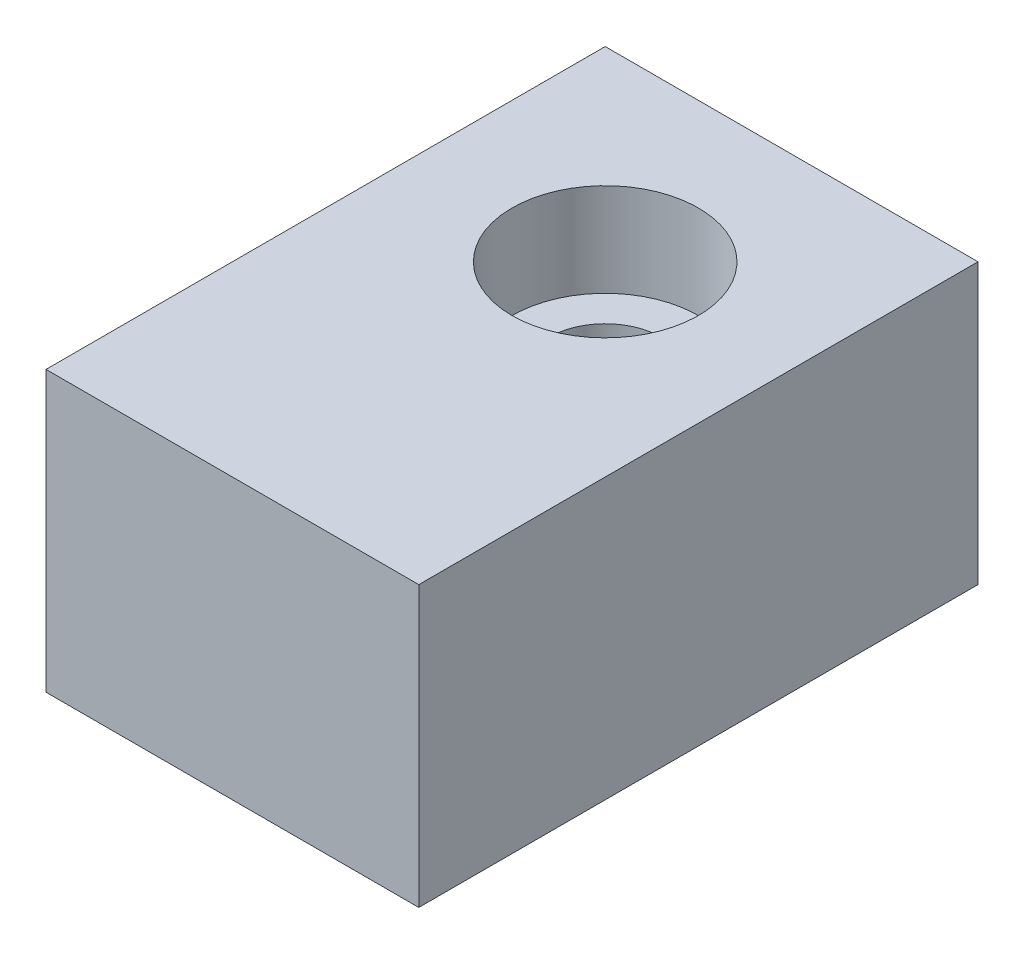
SolidWorks part; units mm, degrees
ref_plane "前视基准面" through (0, 0, 0) normal (0, 0, 1) x (1, 0, 0)
ref_plane "上视基准面" through (0, 0, 0) normal (0, 1, 0) x (1, 0, 0)
ref_plane "右视基准面" through (0, 0, 0) normal (1, 0, 0) x (0, 0, -1)
sketch "草图1" plane through (0, 0, 0) normal (1, 0, 0) x (0, 0, -1)
  line L1 (-15, -7.5) -> (15, -7.5)
  line L2 (-15, -7.5) -> (-15, 7.5)
  line L3 (-15, 7.5) -> (15, 7.5)
  line L4 (15, -7.5) -> (15, 7.5)
  line L5 (-15, -7.5) -> (15, 7.5) construction
  line L6 (-15, 7.5) -> (15, -7.5) construction
  point P0 (0, 0)
  dimension "D1" = 30
  dimension "D2" = 15
extrude "凸台-拉伸1" add sketch "草图1" along normal blind 20
ref_plane "基准面1" through (10, 0, 0) normal (1, 0, 0) x (0, 0, -1)
sketch "草图3" plane through (10, 0, 0) normal (1, 0, 0) x (0, 0, -1)
  line L0 (5, 10.1511) -> (5, -11.1683) construction
  line L1 (5, 7.5232) -> (0, 7.5)
  line L2 (15, 7.5) -> (-15, 7.5) construction
  line L3 (0, 7.5) -> (0, 2.5)
  line L4 (0, 2.5) -> (2, 2.5)
  line L5 (2, 2.5) -> (2, -7.5)
  line L6 (-15, -7.5) -> (15, -7.5) construction
  line L7 (2, -7.5) -> (5, -7.5)
  line L8 (5, -7.5) -> (5, 7.5232)
  dimension "D1" = 5
  dimension "D2" = 3
  dimension "D3" = 5
  dimension "D4" = 10
revolve "切除-旋转1" cut sketch "草图3" angle 360 about L0
